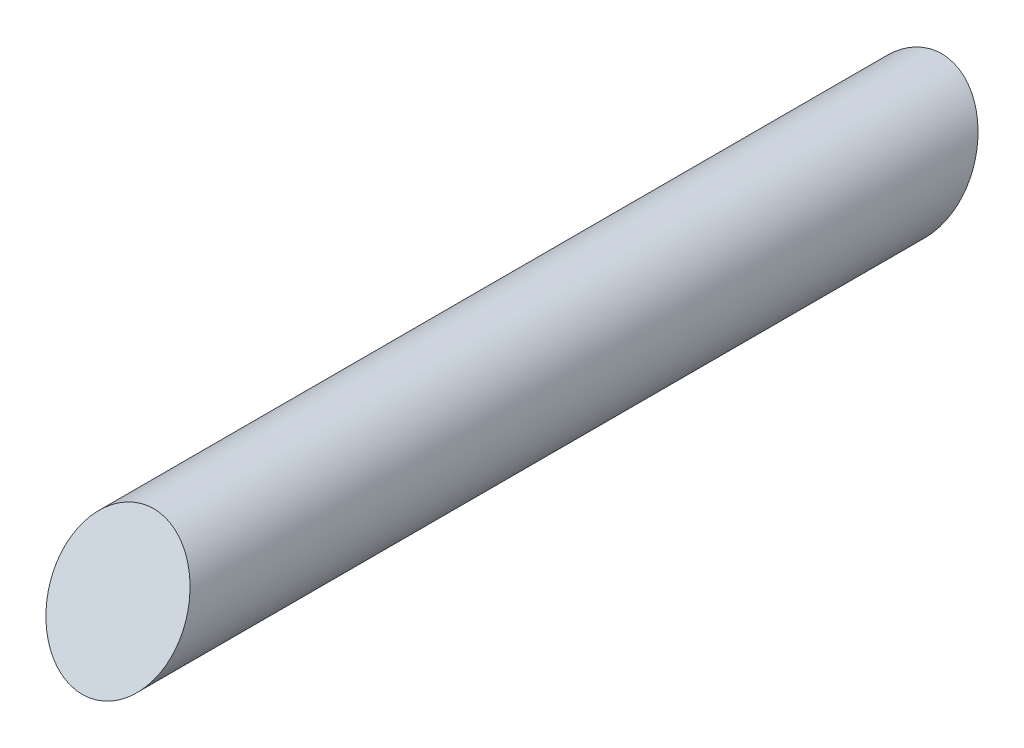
SolidWorks part; units mm, degrees
ref_plane "Front Plane" through (0, 0, 0) normal (0, 0, 1) x (1, 0, 0)
ref_plane "Top Plane" through (0, 0, 0) normal (0, 1, 0) x (1, 0, 0)
ref_plane "Right Plane" through (0, 0, 0) normal (1, 0, 0) x (0, 0, -1)
sketch "Sketch1" plane through (0, 0, 0) normal (0, 0, 1) x (1, 0, 0)
  circle A0 centre (0, 0) radius 38.4081
extrude "Extrude1" add sketch "Sketch1" along normal blind 527.558
sketch "Sketch2" plane through (0, 0, 0) normal (1, 0, 0) x (0, 0, -1)
  line L0 (-527.558, -38.4081) -> (-483.6943, 38.4081)
  line L2 (0, 38.4081) -> (-43.8637, -38.4081)
  line L3 (-527.558, -38.4081) -> (0, -38.4081) construction
  line L4 (0, 38.4081) -> (-527.558, 38.4081) construction
  line L5 (0, 38.4081) -> (-483.6943, 38.4081)
  line L6 (-527.558, -38.4081) -> (-43.8637, -38.4081)
extrude "Cut-Extrude1" cut sketch "Sketch2" against normal through all and the other way through all flip side to cut
